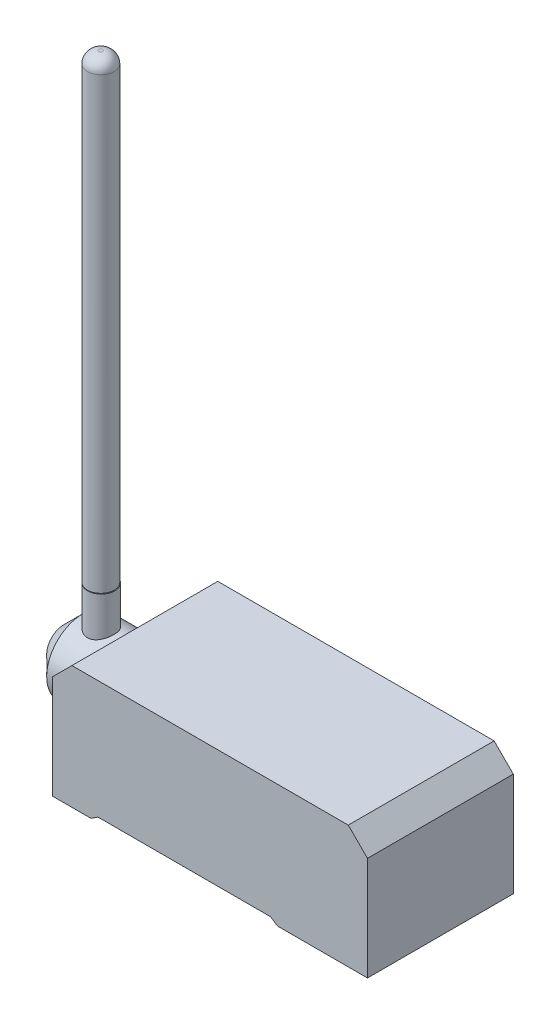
SolidWorks part; units mm, degrees
ref_plane "Plan de face" through (0, 0, 0) normal (0, 0, 1) x (1, 0, 0)
ref_plane "Plan de dessus" through (0, 0, 0) normal (0, 1, 0) x (1, 0, 0)
ref_plane "Plan de droite" through (0, 0, 0) normal (1, 0, 0) x (0, 0, -1)
sketch "Esquisse1" plane through (0, 0, 0) normal (0, 0, 1) x (1, 0, 0)
  line L0 (-54.622, -12.7584) -> (-44.6545, -12.7584)
  line L1 (-44.6545, -12.7584) -> (-42.8603, -11.5623)
  line L2 (-42.8603, -11.5623) -> (2.1397, -11.5623)
  line L3 (2.1397, -11.5623) -> (3.9338, -12.7584)
  line L4 (3.9338, -12.7584) -> (27.378, -12.7584)
  line L5 (27.378, -12.7584) -> (27.378, 19.2416)
  line L6 (27.378, 19.2416) -> (-54.622, 19.2416)
  line L7 (-54.622, 19.2416) -> (-54.622, -12.7584)
  dimension "D1" = 32
  dimension "D2" = 45
  dimension "D3" = 82
extrude "Extrusion1" add sketch "Esquisse1" along normal blind 38
chamfer "Chanfrein1" distance 5 angle 45 1 edges at (-54.622, 19.2416, 19)
chamfer "Chanfrein2" distance 5 angle 45 1 edges at (27.378, 19.2416, 19)
sketch "Esquisse2" plane through (-54.622, 0, 0) normal (-1, 0, 0) x (0, 0, 1)
  circle A0 centre (15.1232, 0.0578) radius 9.4585
extrude "Extrusion2" add sketch "Esquisse2" along normal blind 20
chamfer "Chanfrein3" distance 5 angle 45 1 edges at (-74.622, -9.4007, 15.1232)
sketch "Esquisse3" plane through (0, 19.2416, 0) normal (0, 1, 0) x (-1, 0, 0)
  circle A0 centre (64.6327, 15.4652) radius 3.5
  dimension "D1" = 7
extrude "Extrusion3" add sketch "Esquisse3" along normal blind 120
sketch "Esquisse4" plane through (0, 19.2416, 0) normal (0, -1, 0) x (1, 0, 0)
  circle A0 centre (-64.4409, 15.5544) radius 3.5571
extrude "Extrusion4" add sketch "Esquisse4" along normal blind 20
fillet "Congé1" radius 3 1 edges at (-68.1327, 139.2416, 15.4652)
